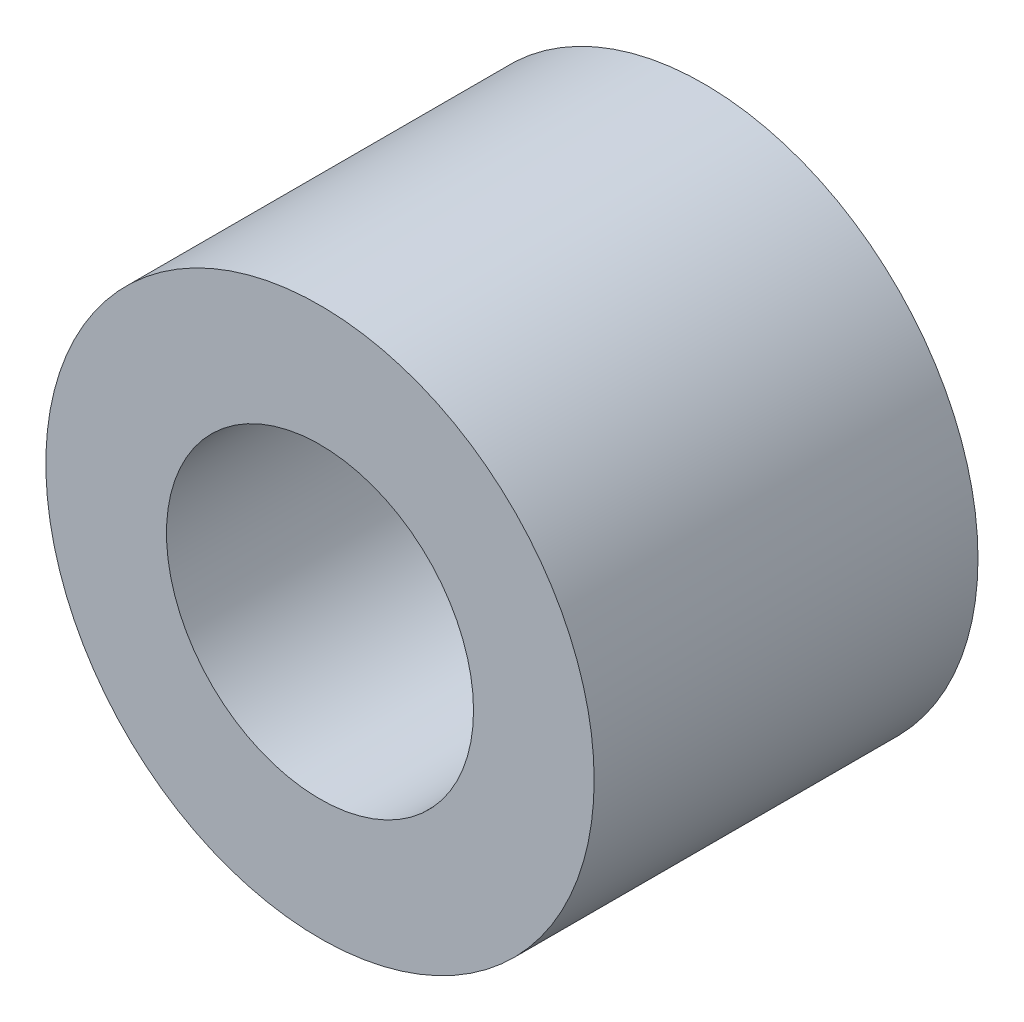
SolidWorks part; units mm, degrees
ref_plane "Front" through (0, 0, 0) normal (0, 0, 1) x (1, 0, 0)
ref_plane "Top" through (0, 0, 0) normal (0, 1, 0) x (1, 0, 0)
ref_plane "Right" through (0, 0, 0) normal (1, 0, 0) x (0, 0, -1)
sketch "Sketch1" plane through (0, 0, 0) normal (0, 0, 1) x (1, 0, 0)
  circle A0 centre (0, 0) radius 2.54
  dimension "D1" = 5.08
extrude "Base-Extrude" add sketch "Sketch1" against normal blind 3.556
hole_wizard "#4-40 Tapped Hole1" positions "Sketch3" profile "Sketch2" tap size "#4-40" standard "Ansi Inch"
sketch "Sketch3" plane through (0, 0, 0) normal (0, 0, 1) x (1, 0, 0)
  point P0 (0, 0)
sketch "Sketch2" plane through (0, 0, 0) normal (1, 0, 0) x (0, -1, 0)
  line L0 (0, 0) -> (0, 3.556)
  line L1 (0, 3.556) -> (1.1303, 3.556)
  line L3 (1.1303, 3.556) -> (1.1303, 5.6896)
  line L4 (1.1303, 5.6896) -> (1.4224, 5.6896)
  line L5 (1.4224, 5.6896) -> (1.4224, 0)
  line L7 (1.4224, 0) -> (0, 0)
  line L11 (0, -6.35) -> (0, 107.95) construction
  dimension "Thru Tap Drill Dia." = 2.2606
  dimension "Thru Tap Drill Depth" = 3.556
  dimension "Thread Dia." = 2.8448
  dimension "Thread Depth" = 5.6896
